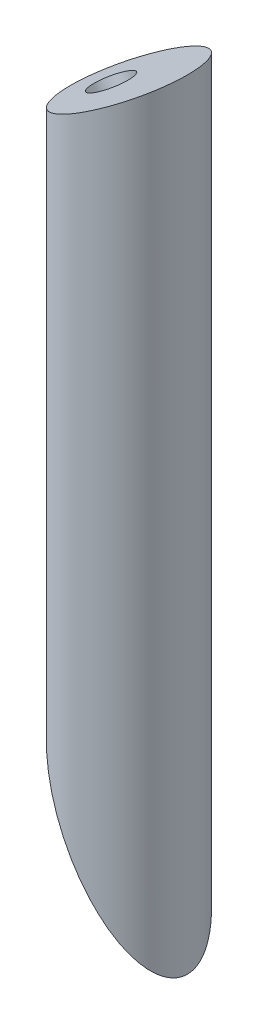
SolidWorks part; units mm, degrees
ref_plane "Front Plane" through (0, 0, 0) normal (0, 0, 1) x (1, 0, 0)
ref_plane "Top Plane" through (0, 0, 0) normal (0, 1, 0) x (1, 0, 0)
ref_plane "Right Plane" through (0, 0, 0) normal (1, 0, 0) x (0, 0, -1)
sketch "Sketch3" plane through (0, 0, 0) normal (0, 1, 0) x (1, 0, 0)
  circle A0 centre (0, 0) radius 7.5
  dimension "D1" = 15
extrude "Boss-Extrude1" add sketch "Sketch3" along normal blind 100
sketch "Sketch5" plane through (0, 0, 0) normal (0, 0, 1) x (1, 0, 0)
  line L0 (7.5, 100) -> (-7.5, 91.3397)
  line L1 (-7.5, 100) -> (-7.5, 0) construction
  line L2 (7.5, 0) -> (-7.5, 25.9808)
  line L3 (7.5, 0) -> (7.5, 100) construction
  line L5 (-7.5, 0) -> (7.5, 0) construction
  line L6 (7.5, 100) -> (-7.5, 100)
  line L7 (-7.5, 100) -> (-7.5, 91.3397)
  line L8 (-7.5, 25.9808) -> (-7.5, 0)
  line L9 (-7.5, 0) -> (7.5, 0)
  dimension "D1" = 60
  dimension "D2" = 60
extrude "Cut-Extrude1" cut sketch "Sketch5" against normal mid plane 100 contours L6 L7 L0 | L8 L9 L2
sketch "Sketch6" plane through (-41.4263, 71.7524, 0) normal (-0.5, 0.866, 0) x (0.866, 0.5, 0)
  circle A0 centre (45.1747, 0) radius 2.5
  ellipse E1 centre (47.8349, 0) end of major axis (39.1747, 0) minor radius 7.5 construction
  point P2 (39.1747, 0)
  dimension "D1" = 5
  dimension "D2" = 6
extrude "Cut-Extrude2" cut sketch "Sketch6" against normal blind 10
sketch "Sketch7" plane through (5.625, 3.2476, 0) normal (-0.866, -0.5, 0) x (0, 0, 1)
  circle A0 centre (0, 18.25) radius 2.5
  ellipse E0 centre (0, 11.25) end of major axis (0, 26.25) minor radius 7.5 construction
  point P0 (0, 26.25)
  dimension "D1" = 5
  dimension "D2" = 8
extrude "Cut-Extrude3" cut sketch "Sketch7" against normal blind 10
